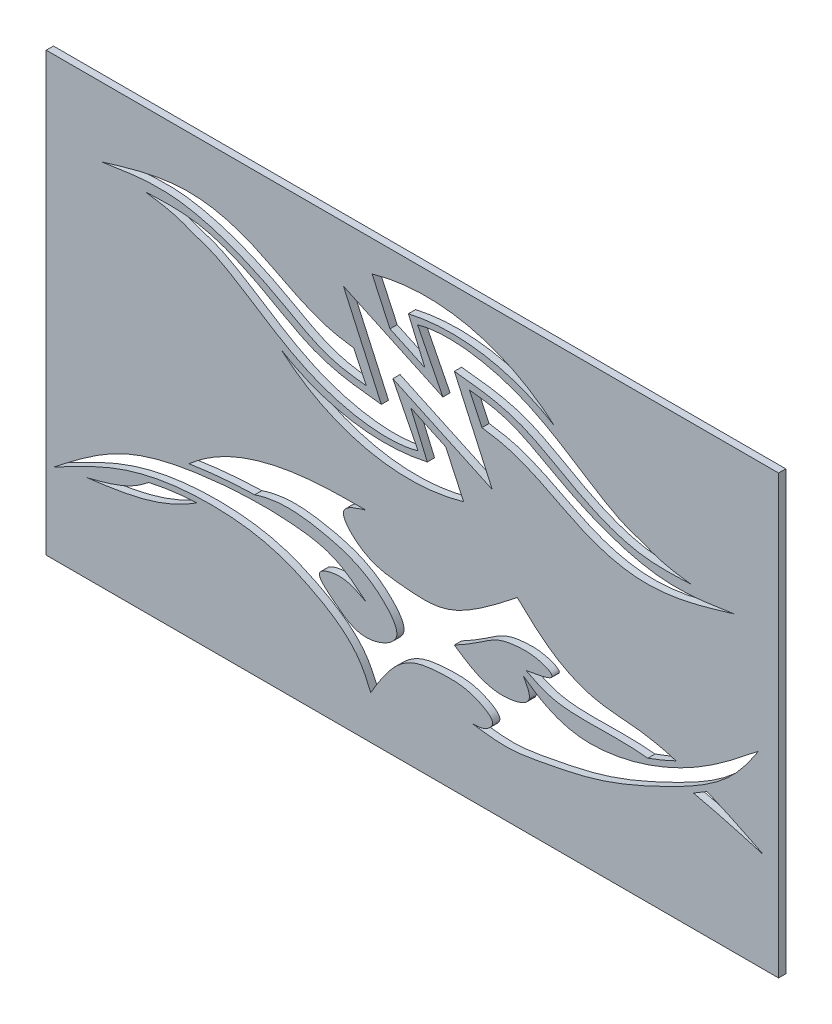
SolidWorks part; units mm, degrees
ref_plane "Vorne" through (0, 0, 0) normal (0, 0, 1) x (1, 0, 0)
ref_plane "Oben" through (0, 0, 0) normal (0, 1, 0) x (1, 0, 0)
ref_plane "Rechts" through (0, 0, 0) normal (1, 0, 0) x (0, 0, -1)
sketch "Skizze1" plane through (0, 0, 0) normal (0, 0, 1) x (1, 0, 0)
  line L1 (0, 0) -> (101.5154, 0)
  line L2 (0, 0) -> (0, 60.6222)
  line L3 (0, 60.6222) -> (101.5154, 60.6222)
  line L4 (101.5154, 0) -> (101.5154, 60.6222)
extrude "Linear austragen1" add sketch "Skizze1" along normal blind 1
sketch "Skizze3"
sketch "Skizze2"
sketch "Skizze4" plane through (0, 0, 1) normal (0, 0, 1) x (1, 0, 0)
  line L0 (46.4489, 41.3236) -> (41.2026, 52.8911)
  line L1 (44.367, 42.5207) -> (42.6368, 46.1812)
  line L3 (51.5495, 38.3048) -> (48.0441, 45.211)
  line L4 (48.0441, 45.211) -> (61.8268, 38.7937)
  line L7 (52.8291, 37.5979) -> (50.5346, 42.9484)
  line L8 (57.8603, 35.3425) -> (55.3803, 40.6921)
  line L10 (50.5346, 42.9484) -> (55.3803, 40.6921)
  line L14 (47.622, 44.3045) -> (61.4047, 37.8871) construction
  line L15 (41.2026, 52.8911) -> (61.8268, 38.7937) construction
  line L16 (56.5806, 50.3611) -> (61.8268, 38.7937)
  line L17 (58.6625, 49.164) -> (60.3926, 45.5035)
  line L18 (51.4799, 53.3799) -> (54.9853, 46.4737)
  line L19 (54.9853, 46.4737) -> (41.2026, 52.8911)
  line L20 (50.2004, 54.0869) -> (52.4949, 48.7364)
  line L21 (45.1691, 56.3423) -> (47.6491, 50.9926)
  line L22 (52.4949, 48.7364) -> (47.6491, 50.9926)
  arc A0 (32.5738, 40.9376) -> (57.8603, 35.3425) centre (50.3419, 61.3011) ccw
  arc A1 (52.8291, 37.5979) -> (32.5738, 40.9376) centre (46.8399, 64.367) cw
  arc A2 (70.4556, 50.7472) -> (45.1691, 56.3423) centre (52.6875, 30.3836) ccw
  arc A3 (50.2004, 54.0869) -> (70.4556, 50.7472) centre (56.1896, 27.3177) cw
  point P5 (13.7109, 50.484)
  point P6 (20.9975, 48.6103)
  point P7 (20.425, 50.3799)
  point P8 (36.8721, 39.9704)
  point P11 (30.4702, 46.6325)
  point P12 (39.9772, 43.2368)
  point P13 (37.913, 42.885)
  point P16 (31.9276, 47.0489)
  point P17 (39.9772, 46.6325)
  point P18 (24.2765, 50.3799)
  point P20 (17.3542, 51.8373)
  point P21 (33.366, 49.2032)
  point P22 (7.6733, 51.0565)
  point P24 (27.8855, 51.8373)
  point P26 (20.9975, 53.4545)
  point P38 (51.5147, 45.8424)
  point P48 (89.3186, 41.2007)
  point P49 (82.0319, 43.0745)
  point P50 (82.6044, 41.3048)
  point P51 (66.1573, 51.7144)
  point P54 (72.5592, 45.0523)
  point P55 (63.0522, 48.448)
  point P56 (65.1164, 48.7997)
  point P59 (71.1019, 44.6359)
  point P60 (63.0522, 45.0523)
  point P61 (78.7529, 41.3048)
  point P62 (85.6752, 39.8475)
  point P63 (69.6634, 42.4815)
  point P64 (95.3561, 40.6282)
  point P66 (75.144, 39.8475)
  point P67 (82.0319, 38.2303)
extrude "Schnitt-Linear austragen1" cut sketch "Skizze4" against normal through all
sketch "Skizze5" plane through (0, 0, 1) normal (0, 0, 1) x (1, 0, 0)
  point P0 (98.7456, 25.8436)
  point P1 (91.597, 20.5172)
  point P2 (95.5217, 21.5685)
  point P3 (83.9577, 16.7326)
  point P4 (66.9281, 16.1589)
  point P5 (76.5288, 15.1207)
  point P6 (85.7799, 15.1207)
  point P7 (74.3561, 15.1207)
  point P8 (66.5209, 19.4165)
  point P9 (69.3801, 16.5224)
  point P10 (76.1783, 11.1959)
  point P11 (66.1562, 18.5548)
  point P12 (64.0196, 14.821)
  point P13 (68.8194, 9.5139)
  point P14 (70.1275, 20.5217)
  point P15 (63.9135, 8.8832)
  point P16 (56.5738, 17.4969)
  point P17 (59.1478, 9.3037)
  point P18 (69.3713, 18.1367)
  point P19 (66.2301, 21.7433)
  point P20 (65.2993, 27.5603)
  point P21 (74.6647, 17.4969)
  point P22 (70.1275, 23.4302)
  point P23 (80.9195, 17.4969)
  point P24 (59.9841, 23.5981)
  point P25 (99.5034, 13.7158)
  point P26 (76.2353, 20.7544)
  point P27 (60.9723, 9.6757)
  point P28 (81.936, 20.1145)
  point P29 (54.3943, 21.0117)
  point P30 (43.5701, 8.8348)
  point P31 (49.4719, 21.0117)
  point P32 (61.8607, 10.6109)
  point P33 (43.3815, 22.8472)
  point P34 (44.2992, 16.5799)
  point P35 (41.2123, 25.8436)
  point P36 (60.0839, 12.3409)
  point P37 (44.2992, 27.5603)
  point P38 (37.0766, 14.1356)
  point P39 (55.1743, 13.1825)
  point P40 (40.2972, 19.4165)
  point P41 (50.8259, 12.4812)
  point P42 (31.1132, 16.516)
  point P43 (44.9811, 5.9818)
  point P44 (42.3246, 17.4969)
  point P45 (23.2945, 17.4969)
  point P46 (34.2827, 20.7876)
  point P47 (11.0363, 15.7259)
  point P48 (35.8998, 27.2464)
  point P49 (1.031, 11.0877)
  point P50 (23.1619, 20.5629)
  point P51 (40.1326, 17.7619)
  point P52 (10.6387, 17.4969)
  point P53 (102.1543, 29.5384)
  point P54 (37.8977, 16.8378)
  point P55 (22.6381, 23.0196)
  point P56 (39.7243, 14.5384)
  point P57 (59.0432, 8.561)
  point P58 (44.9811, 12.3464)
  point P59 (15.3762, 16.8374)
  point P60 (48.5783, 14.6028)
  point P61 (66.5858, 19.1696)
  point P62 (46.9665, 17.633)
  point P63 (44.7804, 17.1552)
  point P64 (37.9406, 21.9525)
  point P65 (-6.2792, 6.3267)
  point P66 (33.7897, 22.4517)
  point P67 (88.3419, 18.6413)
  point P68 (27.6936, 21.2218)
  point P69 (12.4408, 14.5659)
  point P70 (22.0257, 17.4946)
  point P71 (18.7572, 19.9777)
  point P72 (90.7356, 17.7708)
  point P73 (85.0291, 17.136)
  point P74 (5.6779, 12.1355)
  point P75 (88.5781, 16.5383)
  point P76 (44.2921, 5.6856)
  point P79 (20.6832, 16.5799)
  point P80 (14.2901, 13.7158)
  point P81 (26.8226, 20.7876)
  dimension "D1" = 0.75
  dimension "D2" = 0.75
extrude "Schnitt-Linear austragen3" cut sketch "Skizze5" against normal through all
